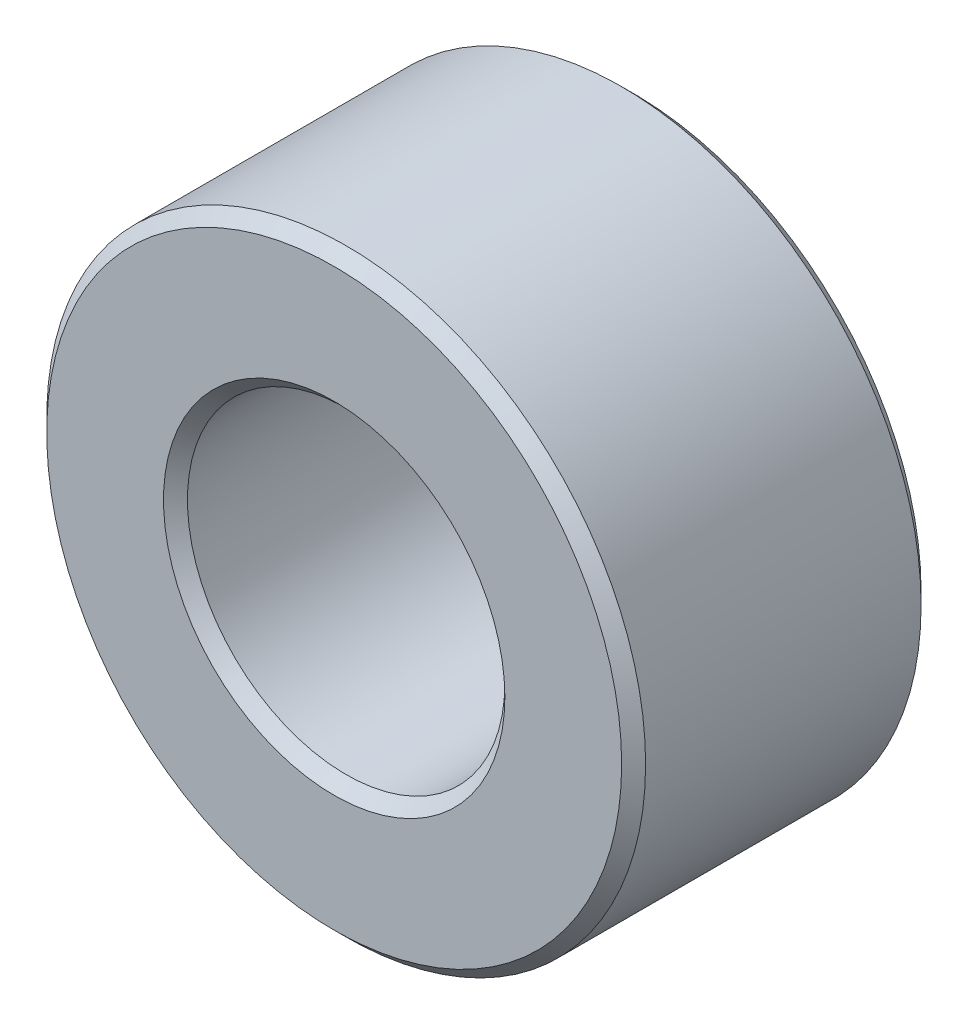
SolidWorks part; units mm, degrees
ref_plane "Front Plane" through (0, 0, 0) normal (0, 0, 1) x (1, 0, 0)
ref_plane "Top Plane" through (0, 0, 0) normal (0, 1, 0) x (1, 0, 0)
ref_plane "Right Plane" through (0, 0, 0) normal (1, 0, 0) x (0, 0, -1)
sketch "Sketch1" plane through (0, 0, 0) normal (0, 0, 1) x (1, 0, 0)
  circle A0 centre (0, 0) radius 5
  circle A1 centre (0, 0) radius 2.65
  dimension "D1" = 10
  dimension "D2" = 5.3
extrude "Boss-Extrude2" add sketch "Sketch1" along normal mid plane 5
chamfer "Chamfer3" distance 0.2 angle 45 4 edges at (5, 0, 2.5) (5, 0, -2.5) (2.65, 0, -2.5) (2.65, 0, 2.5)
